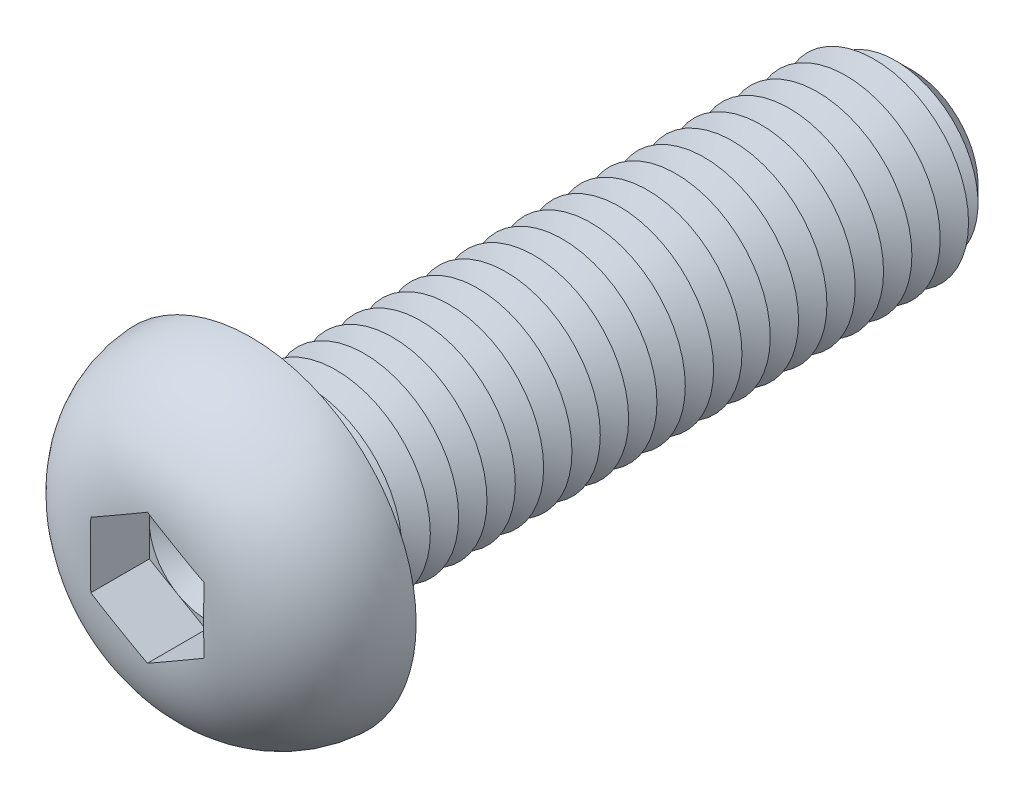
SolidWorks part; units mm, degrees
ref_plane "Front Plane" through (0, 0, 0) normal (0, 0, 1) x (1, 0, 0)
ref_plane "Top Plane" through (0, 0, 0) normal (0, 1, 0) x (1, 0, 0)
ref_plane "Right Plane" through (0, 0, 0) normal (1, 0, 0) x (0, 0, -1)
sketch "Sketch1" plane through (0, 0, 0) normal (1, 0, 0) x (0, 0, -1)
  line L0 (-47.9342, 0) -> (60.3146, 0) construction
sketch "Sketch2" plane through (0, 0, 0) normal (1, 0, 0) x (0, 0, -1)
  line L0 (0, 0) -> (-5.5, 0)
  line L1 (-47.9342, 0) -> (60.3146, 0) construction
  line L2 (-5.5, 0) -> (-5.5, 2.9578)
  line L3 (0, 8.75) -> (0, 0)
  arc A0 (-5.5, 2.9578) -> (0, 8.75) centre (0.3, 2.9578) cw
  dimension "D1" = 5.8
  dimension "D2" = 5.5
  dimension "D3" = 8.75
revolve "Revolve1" add sketch "Sketch2" angle 360 about L0
sketch "Sketch3" plane through (0, 0, 5.5) normal (0, 0, 1) x (1, 0, 0)
  line L1 (0, 3.4641) -> (-3, 1.7321)
  line L2 (-3, 1.7321) -> (-3, -1.7321)
  line L3 (-3, -1.7321) -> (0, -3.4641)
  line L4 (0, -3.4641) -> (3, -1.7321)
  line L5 (3, -1.7321) -> (3, 1.7321)
  line L6 (3, 1.7321) -> (0, 3.4641)
  circle A0 centre (0, 0) radius 3 construction
  dimension "D1" = 6
extrude "Cut-Extrude1" cut sketch "Sketch3" against normal blind 3.12
sketch "Sketch4" plane through (0, 0, 0) normal (0, 0, -1) x (-1, 0, 0)
  circle A0 centre (0, 0) radius 5
  dimension "D1" = 10
extrude "Boss-Extrude1" add sketch "Sketch4" along normal blind 35
chamfer "Chamfer1" distance 1.5 angle 45 1 edges at (-5, 0, -35)
sketch "Sketch5" plane through (0, 0, 0) normal (1, 0, 0) x (0, 0, -1)
  line L0 (1.5, 5) -> (3, 5)
  line L1 (33.5, 5) -> (0, 5) construction
  line L2 (3, 5) -> (2.25, 3.701)
  line L3 (2.25, 3.701) -> (1.5, 5)
  line L4 (0, -8.75) -> (0, 8.75) construction
  line L5 (33.5, 5) -> (0, 5) construction
  dimension "D1" = 1.5
  dimension "D2" = 1.5
revolve "Cut-Revolve1" cut sketch "Sketch5" angle 360 about L0
pattern_linear "LPattern1" count 22 spacing 1.5 along (0, 0, -1) of "Cut-Revolve1"
fillet "Fillet2" radius 0.6 1 edges at (5, 0, 0)
sketch "Sketch6" plane through (0, 0, 2.38) normal (0, 0, 1) x (1, 0, 0)
  line L0 (0, -3.4641) -> (3, -1.7321) construction
  circle A0 centre (0, 0) radius 3
extrude "Cut-Extrude2" cut sketch "Sketch6" against normal through all draft 60
